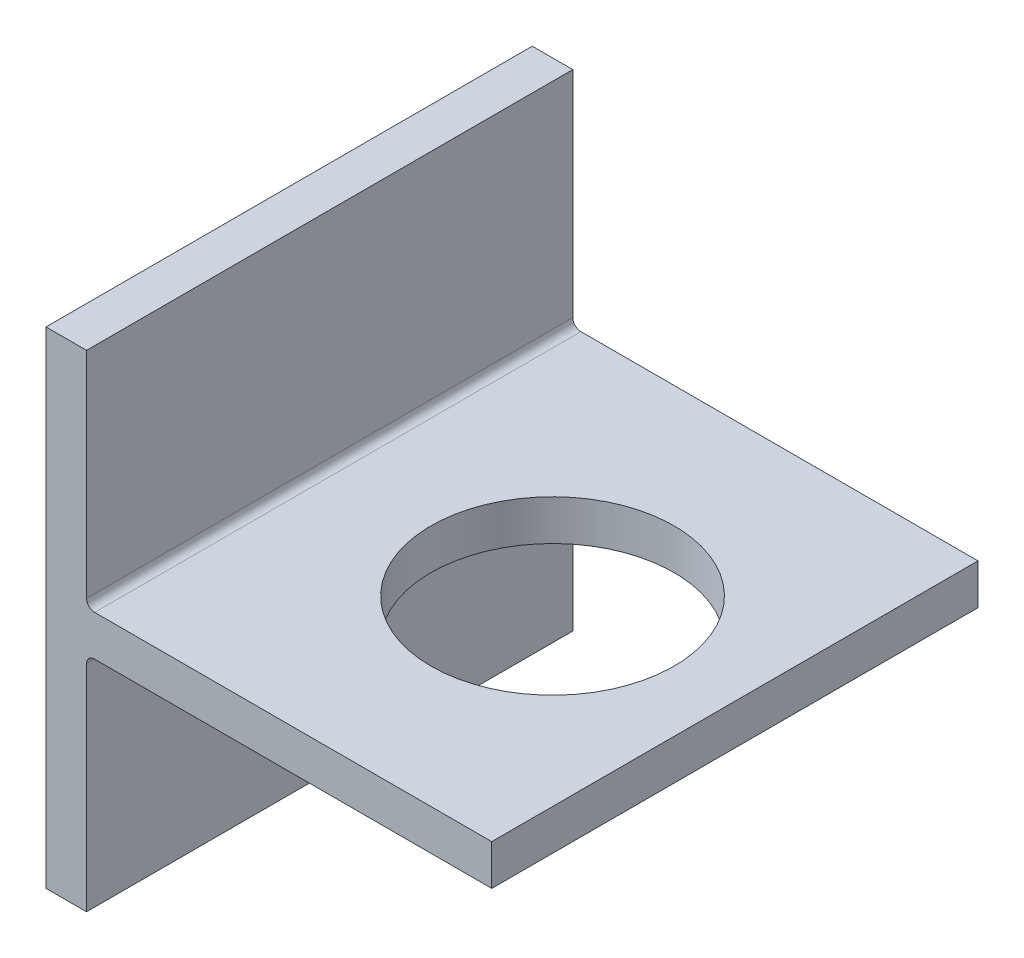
SolidWorks part; units mm, degrees
ref_plane "Front" through (0, 0, 0) normal (0, 0, 1) x (1, 0, 0)
ref_plane "Top" through (0, 0, 0) normal (0, 1, 0) x (1, 0, 0)
ref_plane "Right" through (0, 0, 0) normal (1, 0, 0) x (0, 0, -1)
sketch "Sketch1" plane through (0, 0, 0) normal (0, 0, 1) x (1, 0, 0)
  line L0 (-30.4308, 0) -> (136.341, 0) construction
  line L1 (0, -60) -> (10, -60)
  line L2 (0, -60) -> (0, 60)
  line L3 (0, 60) -> (10, 60)
  line L4 (10, -60) -> (10, -5)
  line L5 (10, -5) -> (110, -5)
  line L6 (10, 5) -> (110, 5)
  line L7 (110, 5) -> (110, -5)
  line L8 (10, 5) -> (10, 60)
  point P13 (10, 5)
  point P15 (10, -5)
  dimension "D1" = 60
  dimension "D2" = 120
  dimension "D4" = 10
  dimension "D5" = 100
extrude "Base-Extrude" add sketch "Sketch1" along normal blind 120
sketch "Sketch2" plane through (0, 0, 0) normal (0, 1, 0) x (-1, 0, 0)
  line L0 (-110, 120) -> (-10, 120) construction
  line L1 (-110, 120) -> (-110, 0) construction
  circle A0 centre (-65, 60) radius 30
  dimension "D1" = 60
  dimension "D3" = 45
  dimension "D2" = 60
fillet "Fillet1" radius 2 2 edges at (10, -5, 60) (10, 5, 60)
extrude "Extrude1" cut sketch "Sketch2" against normal through all and the other way through all
fillet "fillet 2mm" [suppressed] radius 2
